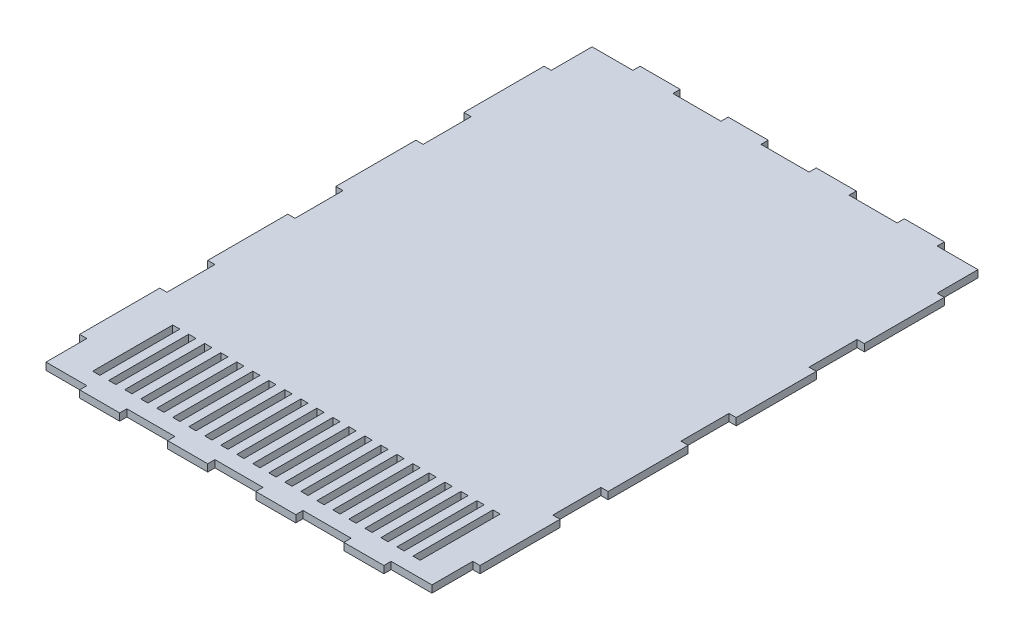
SolidWorks part; units mm, degrees
ref_plane "Front Plane" through (0, 0, 0) normal (0, 0, 1) x (1, 0, 0)
ref_plane "Top Plane" through (0, 0, 0) normal (0, 1, 0) x (1, 0, 0)
ref_plane "Right Plane" through (0, 0, 0) normal (1, 0, 0) x (0, 0, -1)
sketch "Sketch1" plane through (0, 0, 0) normal (0, 1, 0) x (1, 0, 0)
  line L1 (-241, 341) -> (241, 341)
  line L3 (-241, -341) -> (241, -341)
  line L5 (-241, -341) -> (-241, 341)
  line L6 (241, 341) -> (241, -341)
  line L30 (0, 440.4355) -> (0, 0) construction
  line L62 (0, -341) -> (0, -449.134) construction
  point P0 (0, 0)
  dimension "D1" = 682
  dimension "700" = 482
extrude "Boss-Extrude1" add sketch "Sketch1" along normal blind 9
sketch "Sketch3" plane through (0, 9, 0) normal (0, 1, 0) x (1, 0, 0)
  line L0 (241, 341) -> (-241, 341) construction
  line L1 (-190, 341) -> (-140, 341)
  line L2 (-190, 341) -> (-190, 350)
  line L3 (-190, 350) -> (-140, 350)
  line L4 (-140, 341) -> (-140, 350)
  line L6 (-80, 341) -> (-80, 350)
  line L7 (-80, 341) -> (-30, 341)
  line L8 (-30, 341) -> (-30, 350)
  line L9 (-80, 350) -> (-30, 350)
  line L10 (30, 341) -> (30, 350)
  line L11 (30, 341) -> (80, 341)
  line L12 (80, 341) -> (80, 350)
  line L13 (30, 350) -> (80, 350)
  line L14 (140, 341) -> (140, 350)
  line L15 (140, 341) -> (190, 341)
  line L16 (190, 341) -> (190, 350)
  line L17 (140, 350) -> (190, 350)
  line L18 (-408.0022, 0) -> (382.265, 0) construction
  line L19 (-190, -350) -> (-140, -350)
  line L20 (-140, -341) -> (-140, -350)
  line L21 (-190, -341) -> (-140, -341)
  line L22 (-190, -341) -> (-190, -350)
  line L23 (140, -341) -> (190, -341)
  line L24 (190, -341) -> (190, -350)
  line L25 (140, -350) -> (190, -350)
  line L26 (140, -341) -> (140, -350)
  line L27 (30, -341) -> (80, -341)
  line L28 (80, -341) -> (80, -350)
  line L29 (30, -350) -> (80, -350)
  line L30 (30, -341) -> (30, -350)
  line L31 (-80, -341) -> (-30, -341)
  line L32 (-30, -341) -> (-30, -350)
  line L33 (-80, -350) -> (-30, -350)
  line L34 (-80, -341) -> (-80, -350)
  dimension "D1" = 9
  dimension "D2" = 50
  dimension "D3" = 51
  dimension "D5" = 60
  dimension "D4" = 4
extrude "Boss-Extrude2" add sketch "Sketch3" against normal up to surface (9 mm away)
sketch "Sketch4" plane through (0, 9, 0) normal (0, 1, 0) x (1, 0, 0)
  line L0 (-241, 341) -> (-241, -341) construction
  line L1 (-241, 290) -> (-250, 290)
  line L2 (-241, 290) -> (-241, 190)
  line L3 (-241, 190) -> (-250, 190)
  line L4 (-250, 290) -> (-250, 190)
  line L6 (0, 488.2083) -> (0, -14.393) construction
  line L7 (241, 190) -> (250, 190)
  line L8 (250, 290) -> (250, 190)
  line L9 (241, 290) -> (250, 290)
  line L10 (241, 290) -> (241, 190)
  line L11 (-241, 130) -> (-241, 30)
  line L12 (-241, 130) -> (-250, 130)
  line L13 (-250, 130) -> (-250, 30)
  line L14 (-241, 30) -> (-250, 30)
  line L15 (241, 30) -> (250, 30)
  line L16 (250, 130) -> (250, 30)
  line L17 (241, 130) -> (250, 130)
  line L18 (241, 130) -> (241, 30)
  line L19 (-241, -30) -> (-241, -130)
  line L20 (-241, -30) -> (-250, -30)
  line L21 (-250, -30) -> (-250, -130)
  line L22 (-241, -130) -> (-250, -130)
  line L23 (241, -130) -> (250, -130)
  line L24 (250, -30) -> (250, -130)
  line L25 (241, -30) -> (250, -30)
  line L26 (241, -30) -> (241, -130)
  line L27 (-241, -190) -> (-241, -290)
  line L28 (-241, -190) -> (-250, -190)
  line L29 (-250, -190) -> (-250, -290)
  line L30 (-241, -290) -> (-250, -290)
  line L31 (241, -290) -> (250, -290)
  line L32 (250, -190) -> (250, -290)
  line L33 (241, -190) -> (250, -190)
  line L34 (241, -190) -> (241, -290)
  dimension "D1" = 9
  dimension "D2" = 100
  dimension "D3" = 51
  dimension "D4" = 4
extrude "Boss-Extrude3" add sketch "Sketch4" against normal up to surface (9 mm away)
sketch "Sketch5" plane through (0, 9, 0) normal (0, 1, 0) x (1, 0, 0)
  line L0 (-241, -290) -> (-241, -341) construction
  line L1 (-211, -221.7332) -> (211, -221.7332) construction
  line L2 (-211, -221.7332) -> (-211, -321.7332) construction
  line L3 (-211, -321.7332) -> (211, -321.7332) construction
  line L4 (211, -221.7332) -> (211, -321.7332) construction
  line L5 (241, -341) -> (241, -290) construction
  line L6 (-182, -221.7332) -> (-182, -321.7332)
  line L7 (-202, -221.7332) -> (-193, -221.7332)
  line L8 (-202, -221.7332) -> (-202, -321.7332)
  line L9 (-202, -321.7332) -> (-193, -321.7332)
  line L10 (-193, -221.7332) -> (-193, -321.7332)
  line L11 (-182, -221.7332) -> (-173, -221.7332)
  line L12 (-173, -221.7332) -> (-173, -321.7332)
  line L13 (-182, -321.7332) -> (-173, -321.7332)
  line L14 (-162, -221.7332) -> (-162, -321.7332)
  line L15 (-162, -221.7332) -> (-153, -221.7332)
  line L16 (-153, -221.7332) -> (-153, -321.7332)
  line L17 (-162, -321.7332) -> (-153, -321.7332)
  line L18 (-142, -221.7332) -> (-142, -321.7332)
  line L19 (-142, -221.7332) -> (-133, -221.7332)
  line L20 (-133, -221.7332) -> (-133, -321.7332)
  line L21 (-142, -321.7332) -> (-133, -321.7332)
  line L22 (-122, -221.7332) -> (-122, -321.7332)
  line L23 (-122, -221.7332) -> (-113, -221.7332)
  line L24 (-113, -221.7332) -> (-113, -321.7332)
  line L25 (-122, -321.7332) -> (-113, -321.7332)
  line L26 (-102, -221.7332) -> (-102, -321.7332)
  line L27 (-102, -221.7332) -> (-93, -221.7332)
  line L28 (-93, -221.7332) -> (-93, -321.7332)
  line L29 (-102, -321.7332) -> (-93, -321.7332)
  line L30 (-82, -221.7332) -> (-82, -321.7332)
  line L31 (-82, -221.7332) -> (-73, -221.7332)
  line L32 (-73, -221.7332) -> (-73, -321.7332)
  line L33 (-82, -321.7332) -> (-73, -321.7332)
  line L34 (-62, -221.7332) -> (-62, -321.7332)
  line L35 (-62, -221.7332) -> (-53, -221.7332)
  line L36 (-53, -221.7332) -> (-53, -321.7332)
  line L37 (-62, -321.7332) -> (-53, -321.7332)
  line L38 (-42, -221.7332) -> (-42, -321.7332)
  line L39 (-42, -221.7332) -> (-33, -221.7332)
  line L40 (-33, -221.7332) -> (-33, -321.7332)
  line L41 (-42, -321.7332) -> (-33, -321.7332)
  line L42 (-22, -221.7332) -> (-22, -321.7332)
  line L43 (-22, -221.7332) -> (-13, -221.7332)
  line L44 (-13, -221.7332) -> (-13, -321.7332)
  line L45 (-22, -321.7332) -> (-13, -321.7332)
  line L46 (-2, -221.7332) -> (-2, -321.7332)
  line L47 (-2, -221.7332) -> (7, -221.7332)
  line L48 (7, -221.7332) -> (7, -321.7332)
  line L49 (-2, -321.7332) -> (7, -321.7332)
  line L50 (18, -221.7332) -> (18, -321.7332)
  line L51 (18, -221.7332) -> (27, -221.7332)
  line L52 (27, -221.7332) -> (27, -321.7332)
  line L53 (18, -321.7332) -> (27, -321.7332)
  line L54 (38, -221.7332) -> (38, -321.7332)
  line L55 (38, -221.7332) -> (47, -221.7332)
  line L56 (47, -221.7332) -> (47, -321.7332)
  line L57 (38, -321.7332) -> (47, -321.7332)
  line L58 (58, -221.7332) -> (58, -321.7332)
  line L59 (58, -221.7332) -> (67, -221.7332)
  line L60 (67, -221.7332) -> (67, -321.7332)
  line L61 (58, -321.7332) -> (67, -321.7332)
  line L62 (78, -221.7332) -> (78, -321.7332)
  line L63 (78, -221.7332) -> (87, -221.7332)
  line L64 (87, -221.7332) -> (87, -321.7332)
  line L65 (78, -321.7332) -> (87, -321.7332)
  line L66 (98, -221.7332) -> (98, -321.7332)
  line L67 (98, -221.7332) -> (107, -221.7332)
  line L68 (107, -221.7332) -> (107, -321.7332)
  line L69 (98, -321.7332) -> (107, -321.7332)
  line L70 (118, -221.7332) -> (118, -321.7332)
  line L71 (118, -221.7332) -> (127, -221.7332)
  line L72 (127, -221.7332) -> (127, -321.7332)
  line L73 (118, -321.7332) -> (127, -321.7332)
  line L74 (138, -221.7332) -> (138, -321.7332)
  line L75 (138, -221.7332) -> (147, -221.7332)
  line L76 (147, -221.7332) -> (147, -321.7332)
  line L77 (138, -321.7332) -> (147, -321.7332)
  line L78 (158, -221.7332) -> (158, -321.7332)
  line L79 (158, -221.7332) -> (167, -221.7332)
  line L80 (167, -221.7332) -> (167, -321.7332)
  line L81 (158, -321.7332) -> (167, -321.7332)
  line L82 (178, -221.7332) -> (178, -321.7332)
  line L83 (178, -221.7332) -> (187, -221.7332)
  line L84 (187, -221.7332) -> (187, -321.7332)
  line L85 (178, -321.7332) -> (187, -321.7332)
  line L86 (198, -221.7332) -> (198, -321.7332)
  line L87 (198, -221.7332) -> (207, -221.7332)
  line L88 (207, -221.7332) -> (207, -321.7332)
  line L89 (198, -321.7332) -> (207, -321.7332)
  dimension "D1" = 100
  dimension "D2" = 30
  dimension "D3" = 30
  dimension "D4" = 9
  dimension "D5" = 9
  dimension "D6" = 21
extrude "Cut-Extrude1" cut sketch "Sketch5" against normal through all
